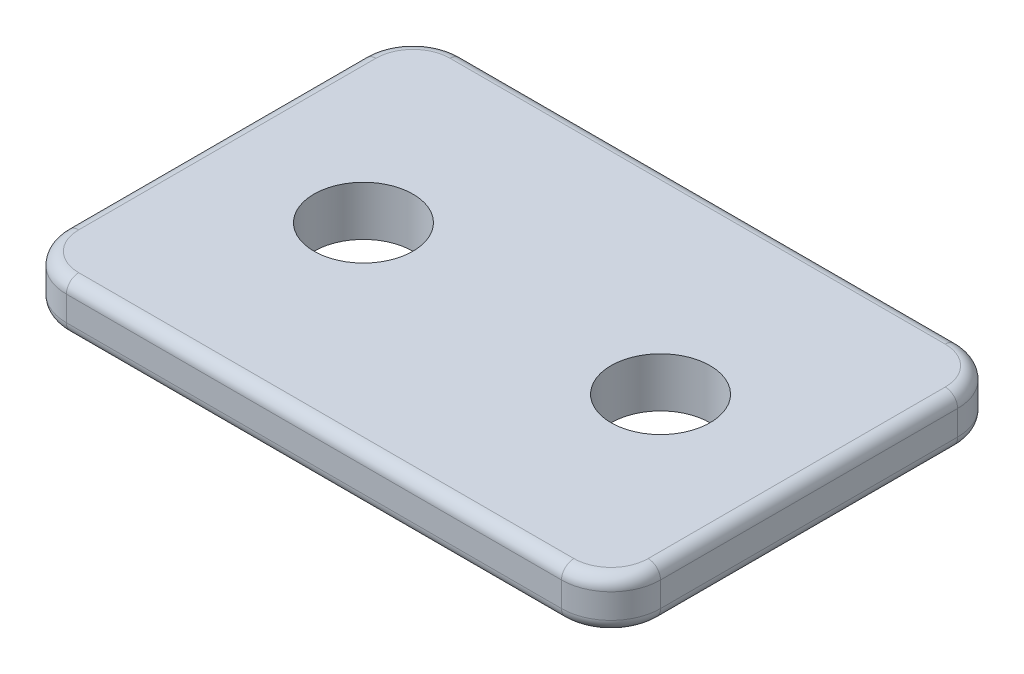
SolidWorks part; units mm, degrees
ref_plane "front" through (0, 0, 0) normal (0, 0, 1) x (1, 0, 0)
ref_plane "top" through (0, 0, 0) normal (0, 1, 0) x (1, 0, 0)
ref_plane "side" through (0, 0, 0) normal (1, 0, 0) x (0, 0, -1)
sketch "Sketch1" plane through (0, 0, 0) normal (0, 0, 1) x (1, 0, 0)
  line L0 (0, 0) -> (76.2, 0)
  line L1 (0, 0) -> (0, 6.35)
  line L2 (76.2, 6.35) -> (0, 6.35)
  line L3 (76.2, 6.35) -> (76.2, 0)
  dimension "D1" = 76.2
  dimension "D2" = 6.35
extrude "Base-Extrude" add sketch "Sketch1" along normal blind 50.8
sketch "Sketch2" plane through (0, 6.35, 0) normal (0, 1, 0) x (-1, 0, 0)
  line L0 (-76.2, 25.4) -> (0, 25.4) construction
  line L3 (-76.2, 50.8) -> (-76.2, 0) construction
  line L4 (0, 50.8) -> (0, 0) construction
  circle A0 centre (-57.15, 25.4) radius 6.35
  circle A2 centre (-19.05, 25.4) radius 6.35
  dimension "D1" = 12.7
  dimension "D2" = 19.05
  dimension "D3" = 19.05
extrude "Cut-Extrude1" cut sketch "Sketch2" against normal through all
fillet "Fillet1" radius 6.35 4 edges at (76.2, 3.175, 50.8) (0, 3.175, 50.8) (76.2, 3.175, 0) (0, 3.175, 0)
fillet "Fillet2" radius 1.5875 16 edges at (0, 0, 25.4) (0, 6.35, 25.4) (38.1, 6.35, 0) (38.1, 6.35, 50.8) (76.2, 6.35, 25.4) (74.3401, 6.35, 48.9401) (74.3401, 6.35, 1.8599) (1.8599, 6.35, 1.8599) (1.8599, 6.35, 48.9401) (38.1, 0, 50.8) (38.1, 0, 0) (76.2, 0, 25.4) (74.3401, 0, 48.9401) (74.3401, 0, 1.8599) (1.8599, 0, 1.8599) (1.8599, 0, 48.9401)
